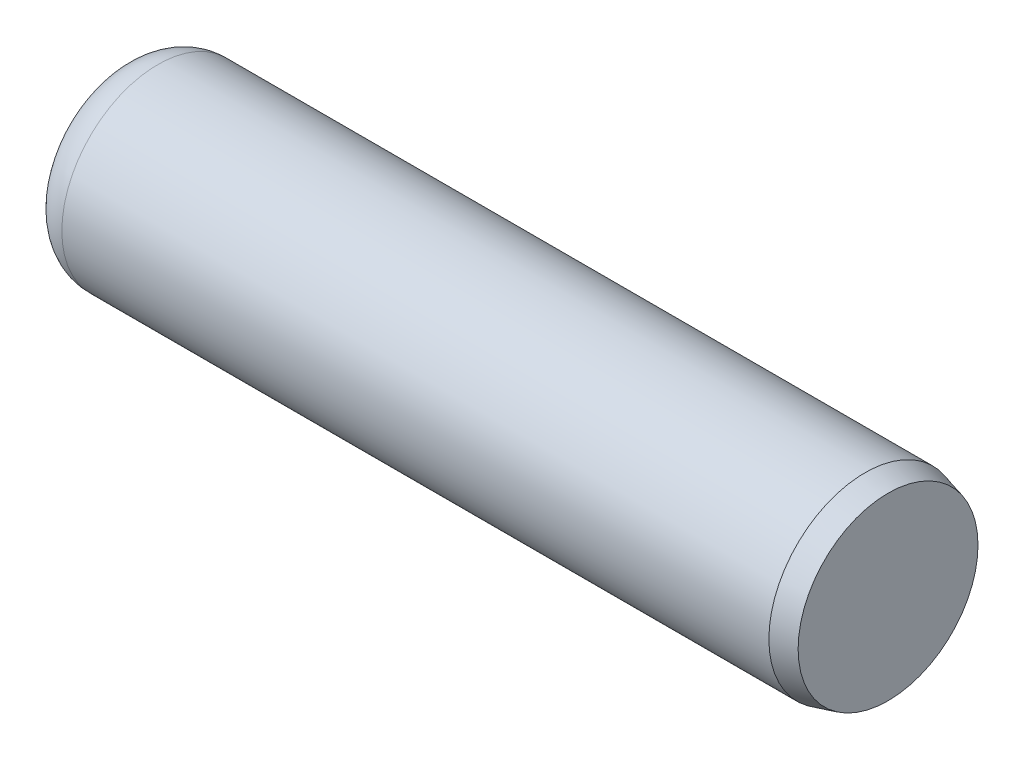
SolidWorks part; units mm, degrees
ref_plane "Plane1" through (0, 0, 0) normal (0, 0, 1) x (1, 0, 0)
ref_plane "Plane2" through (0, 0, 0) normal (0, 1, 0) x (1, 0, 0)
ref_plane "Plane3" through (0, 0, 0) normal (1, 0, 0) x (0, 0, -1)
sketch "Sketch1" plane through (0, 0, 0) normal (0, 0, 1) x (1, 0, 0)
  line L1 (-6.35, 0) -> (107.95, 0) construction
  line L2 (0, 0) -> (9.525, 0)
  line L3 (9.525, 0) -> (9.525, 1.1147)
  line L4 (9.525, 1.1147) -> (9.2391, 1.1913)
  line L5 (9.2391, 1.1913) -> (0.4765, 1.1913)
  line L6 (0, 0.7148) -> (0, 0)
  arc A0 (0.4765, 1.1913) -> (0, 0.7148) centre (0.4765, 0.7148) ccw
revolve "Base-Revolve" add sketch "Sketch1" angle 360 about L1
equation "\"D4@Sketch1\" = \"Diameter@Sketch1\" * 0.2"
equation "\"D2@Sketch1\" = \"Diameter@Sketch1\" * 0.12"
equation "\"D3@Sketch1\" = 15.0"
